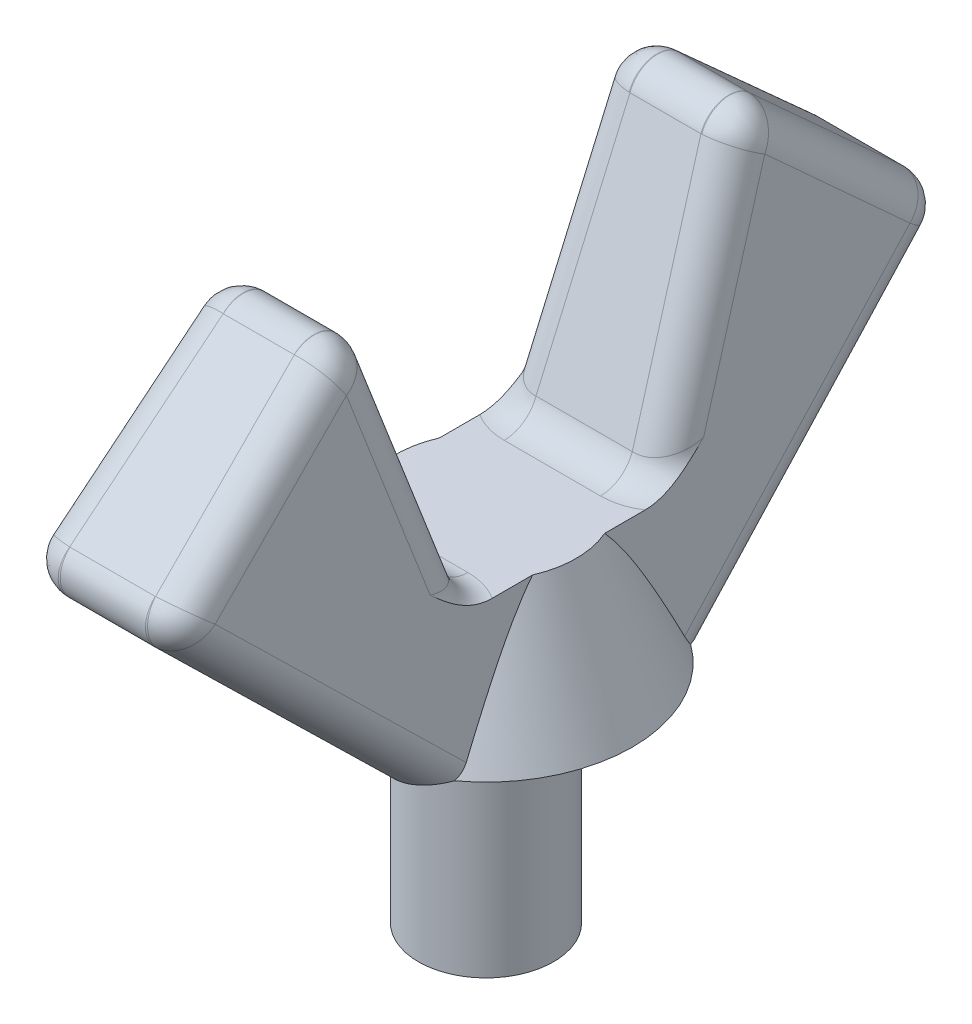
SolidWorks part; units mm, degrees
ref_plane "Front Plane" through (0, 0, 0) normal (0, 0, 1) x (1, 0, 0)
ref_plane "Top Plane" through (0, 0, 0) normal (0, 1, 0) x (1, 0, 0)
ref_plane "Right Plane" through (0, 0, 0) normal (1, 0, 0) x (0, 0, -1)
sketch "Sketch1" plane through (0, 0, 0) normal (0, 0, 1) x (1, 0, 0)
  line L0 (0, 60.5151) -> (0, -41.7102) construction
  line L1 (0, 0) -> (-1.5, 0)
  line L2 (-1.5, 0) -> (-1.5, 5)
  line L3 (-1.5, 5) -> (-3.25, 5)
  line L4 (-3.25, 5) -> (-2, 8)
  line L5 (-2, 8) -> (0, 8)
  line L6 (0, 0) -> (0, 8)
  dimension "D1" = 5
  dimension "D2" = 3
  dimension "D3" = 3
  dimension "D4" = 6.5
  dimension "D5" = 4
revolve "Revolve1" add sketch "Sketch1" angle 360 about L0
sketch "Sketch2" plane through (0, 0, 0) normal (0, 0, 1) x (1, 0, 0)
  line L0 (0, 5) -> (0, 14) construction
  line L1 (-1.5, 5) -> (1.5, 5) construction
  line L2 (2, 5) -> (-2, 5)
  line L3 (-2, 5) -> (-1.5, 14)
  line L4 (-1.5, 14) -> (1.5, 14)
  line L5 (-3.25, 5) -> (3.25, 5) construction
  line L6 (2, 5) -> (1.5, 14)
  dimension "D1" = 3
  dimension "D2" = 4
  dimension "D3" = 9
extrude "Extrude1" add sketch "Sketch2" along normal mid plane 17 separate body
sketch "Sketch5" plane through (0, 0, 0) normal (1, 0, 0) x (0, 0, -1)
  line L0 (-3.25, 5) -> (-8.3018, 9.9297)
  line L2 (-8.5, 5) -> (-8.5, 14) construction
  line L4 (-3.9809, 13.5633) -> (-2, 8)
  line L5 (-2, 8) -> (-3.25, 5) construction
  line L6 (0, 0) -> (0, 20.6602) construction
  line L7 (-2, 8) -> (2, 8)
  line L8 (2, 8) -> (-2, 8) construction
  line L9 (-3.25, 5) -> (-9.5, 5)
  line L10 (-9.5, 5) -> (-9.5, 15)
  line L11 (-9.5, 15) -> (9.5, 15)
  line L12 (9.5, 5) -> (9.5, 15)
  line L13 (3.25, 5) -> (9.5, 5)
  line L14 (3.25, 5) -> (8.3018, 9.9297)
  line L15 (8.2845, 10.8866) -> (5.0416, 13.8295)
  line L16 (3.9809, 13.5633) -> (2, 8)
  line L17 (-8.2845, 10.8866) -> (-5.0416, 13.8295)
  line L18 (-8.5, 14) -> (8.5, 14) construction
  arc A0 (-8.2845, 10.8866) -> (-8.3018, 9.9297) centre (-7.8429, 10.4) ccw
  arc A1 (-5.0416, 13.8295) -> (-3.9809, 13.5633) centre (-4.6, 13.3429) cw
  arc A2 (5.0416, 13.8295) -> (3.9809, 13.5633) centre (4.6, 13.3429) ccw
  arc A3 (8.2845, 10.8866) -> (8.3018, 9.9297) centre (7.8429, 10.4) cw
  point P23 (0, 15)
  point P26 (0, 8)
  dimension "D5" = 0.6571
  dimension "D6" = 0.6571
  dimension "D1" = 4.6
  dimension "D2" = 19
  dimension "D3" = 5.4
  dimension "D4" = 10
extrude "Cut-Extrude1" cut sketch "Sketch5" against normal through all and the other way through all
combine bodies "Combine1" operation type add bodies to combine 103 101
fillet "Fillet2" radius 0.75 20 edges at (1.8631, 7.4648, -5.7759) (1.6993, 10.4119, -8.4999) (1.5912, 12.3581, -6.663) (1.5011, 13.9802, -4.44) (-1.8631, 7.4648, -5.7759) (-1.6993, 10.4119, -8.4999) (-1.5912, 12.3581, -6.663) (-1.5011, 13.9802, -4.44) (-1.8631, 7.4648, 5.7759) (-1.6993, 10.4119, 8.4999) (-1.5912, 12.3581, 6.663) (-1.5011, 13.9802, 4.44) (1.8631, 7.4648, 5.7759) (1.6993, 10.4119, 8.4999) (1.5912, 12.3581, 6.663) (1.5011, 13.9802, 4.44) (1.6788, 10.7816, -2.9905) (-1.6788, 10.7816, -2.9905) (-1.6788, 10.7816, 2.9905) (1.6788, 10.7816, 2.9905)
fillet "Fillet3" radius 0.75 6 edges at (-1.6182, 8, -2.228) (1.6182, 8, -2.228) (-1.6182, 8, 2.228) (1.6182, 8, 2.228) (0, 8, -2) (0, 8, 2)
chamfer "Chamfer1" [suppressed] distance 0.6 angle 45
sketch "Sketch6" plane through (0, 0, 0) normal (1, 0, 0) x (0, 0, -1)
  line L0 (0, 8) -> (0, 0) construction
  line L1 (0, 0) -> (0, -0.1)
  line L2 (0, -0.1) -> (1.6, -0.1)
  line L3 (1.6, -0.1) -> (1.6, 0.6)
  line L4 (1.6, 0.6) -> (1.5, 0.6)
  line L5 (0.7993, 8) -> (-0.7993, 8) construction
  line L6 (-1.5, 0) -> (1.5, 0) construction
  arc A0 (0, 0) -> (1.5, 0.6) centre (0, 2.175) ccw
  dimension "D1" = 0.6
  dimension "D2" = 0.1
  dimension "D3" = 0.1
  dimension "D4" = 3
revolve "Cut-Revolve1" [suppressed] cut sketch "Sketch6" angle 360 about L0
sketch "Sketch7" plane through (0, 0, 0) normal (1, 0, 0) x (0, 0, -1)
  line L0 (1.5, 5) -> (0.9804, 4.7)
  line L1 (0.9804, 4.7) -> (1.5, 4.4)
  line L2 (1.5, 4.4) -> (1.6, 4.4)
  line L3 (1.6, 4.4) -> (1.6, 5)
  line L4 (1.6, 5) -> (1.5, 5)
  line L5 (0.9804, 4.7) -> (1.6, 4.7) construction
  line L6 (0, 0) -> (0, 8) construction
  line L7 (0.7993, 8) -> (-0.7993, 8) construction
  line L8 (-2.623, 5) -> (2.623, 5) construction
  dimension "D1" = 0.1
  dimension "D2" = 60
  dimension "D3" = 0.6
  dimension "D4" = 3
revolve "Cut-Revolve10" [suppressed] cut sketch "Sketch7" angle 360 about L6
pattern_linear "LPattern10" [suppressed] count 7 spacing 0.72 along (0, -1, 0)
equation "\"D4@Sketch5\" = \"D3@Sketch2\" + 1"
equation "\"D2@Sketch5\" =\"D1@Extrude1\" + 2"
equation "\"D3@Sketch5\" =3 / 5 *  \"D3@Sketch2\""
equation "\"D1@Sketch5\" =   \"D1@Extrude1\" / 5  + 3 / 10 * \"D5@Sketch1\""
equation "\"D6@Sketch5\" = \"D1@Sketch5\" / 7"
equation "\"D5@Sketch5\" = \"D6@Sketch5\""
equation "\"D1@ThreadCosmetic1\" = \"D1@Sketch1\""
equation "\"D2@ThreadCosmetic1\" = \"D3@Sketch1\" - 2 * \"D1@Chamfer1\""
equation "\"D1@Fillet2\" = \"D1@Sketch2\" / 4"
equation "\"D1@Fillet3\" = \"D1@Sketch2\" / 4"
equation "\"D1@Sketch6\" = \"D1@Chamfer1\""
equation "\"D4@Sketch6\" = \"D3@Sketch1\""
equation "\"D3@Sketch7\" = \"D1@Chamfer1\" "
equation "\"D4@Sketch7\" = \"D3@Sketch1\""
equation "\"D3@LPattern10\" = \"D3@Sketch7\" *1.2"
equation "\"D1@LPattern10\" = \"D1@ThreadCosmetic1\" / \"D3@LPattern10\""
